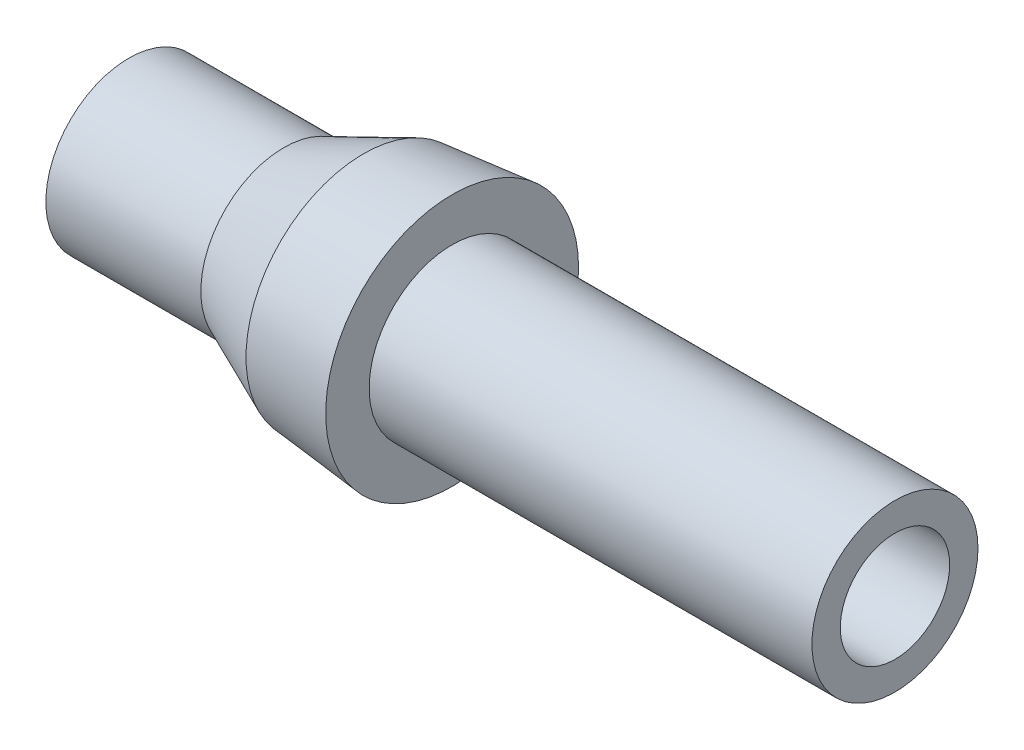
SolidWorks part; units mm, degrees
ref_plane "Front Plane" through (0, 0, 0) normal (0, 0, 1) x (1, 0, 0)
ref_plane "Top Plane" through (0, 0, 0) normal (0, 1, 0) x (1, 0, 0)
ref_plane "Right Plane" through (0, 0, 0) normal (1, 0, 0) x (0, 0, -1)
sketch "Sketch1" plane through (0, 0, 0) normal (0, 1, 0) x (1, 0, 0)
  line L0 (0, 0) -> (0, 2.3813)
  line L1 (0, 2.3813) -> (4.445, 2.3813)
  line L2 (0, 0) -> (21.971, 0)
  line L4 (6.731, 3.3719) -> (4.445, 2.3813)
  line L6 (9.271, 2.3813) -> (9.271, 3.6258)
  line L7 (9.271, 3.6258) -> (6.731, 3.3719)
  line L8 (9.271, 2.3813) -> (21.971, 2.3813)
  line L9 (21.971, 2.3813) -> (21.971, 0)
  line L10 (21.971, 0) -> (0, 0) construction
  dimension "D1" = 2.3813
  dimension "D2" = 4.445
  dimension "D5" = 1.2446
revolve "Revolve1" add sketch "Sketch1" angle 360 about L10
sketch "Sketch2" plane through (21.971, 0, 0) normal (1, 0, 0) x (0, 0, -1)
  circle A0 centre (0, 0) radius 1.5684
extrude "Cut-Extrude1" cut sketch "Sketch2" against normal through all
